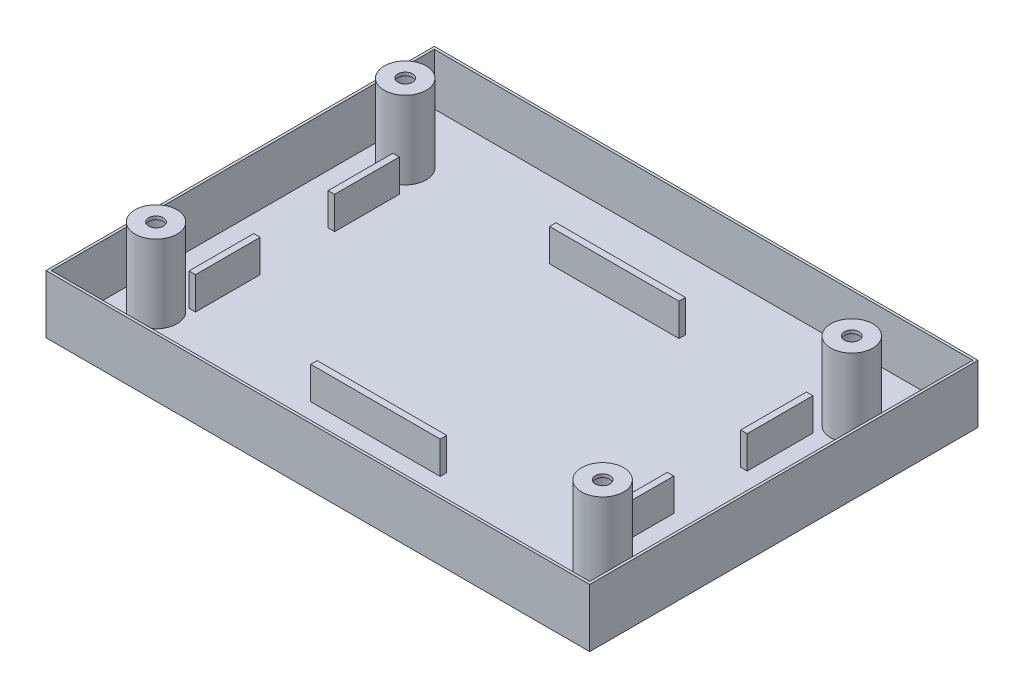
SolidWorks part; units mm, degrees
ref_plane "Front Plane" through (0, 0, 0) normal (0, 0, 1) x (1, 0, 0)
ref_plane "Top Plane" through (0, 0, 0) normal (0, 1, 0) x (1, 0, 0)
ref_plane "Right Plane" through (0, 0, 0) normal (1, 0, 0) x (0, 0, -1)
sketch "Sketch4" plane through (0, 0, 0) normal (0, 1, 0) x (1, 0, 0)
  line L1 (0, 0) -> (84, 0)
  line L2 (0, 0) -> (0, 60)
  line L3 (0, 60) -> (84, 60)
  line L4 (84, 0) -> (84, 60)
  dimension "D1" = 60
  dimension "D2" = 84
extrude "Boss-Extrude2" add sketch "Sketch4" along normal blind 9 contours L2 L1 L4 L3
sketch "Sketch5" plane through (0, 9, 0) normal (0, 1, 0) x (1, 0, 0)
  line L5 (0.4, 0.4) -> (83.6, 0.4)
  line L6 (0.4, 0.4) -> (0.4, 59.6)
  line L7 (0.4, 59.6) -> (83.6, 59.6)
  line L8 (83.6, 0.4) -> (83.6, 59.6)
  dimension "D1" = 59.2
  dimension "D2" = 83.2
extrude "Cut-Extrude2" cut sketch "Sketch5" against normal blind 8
sketch "Sketch6" plane through (0, 0, 0) normal (0, -1, 0) x (1, 0, 0)
  line L1 (79, -7) -> (2, -7)
  line L2 (79, -7) -> (79, -53.5)
  line L3 (79, -53.5) -> (2, -53.5)
  line L4 (2, -7) -> (2, -53.5)
  dimension "D1" = 46.5
  dimension "D2" = 77
sketch "Sketch7" plane through (0, 0, 0) normal (0, -1, 0) x (-1, 0, 0)
  circle A0 centre (-6, 11) radius 0.75
  circle A1 centre (-6, 49.5) radius 0.75
  circle A2 centre (-75, 49.5) radius 0.75
  circle A3 centre (-75, 11) radius 0.75
sketch "Sketch8" plane through (0, 1, 0) normal (0, 1, 0) x (1, 0, 0)
  line L1 (9.5, 12) -> (71.7, 12)
  line L2 (9.5, 12) -> (9.5, 47.5)
  line L3 (9.5, 47.5) -> (71.7, 47.5)
  line L4 (71.7, 12) -> (71.7, 47.5)
  dimension "D1" = 35.5
  dimension "D2" = 62.2
sketch "Sketch9" plane through (0, 1, 0) normal (0, 1, 0) x (1, 0, 0)
  line L0 (8.1, 35.5) -> (9.1, 35.5)
  line L1 (8.1, 14) -> (9.1, 14)
  line L2 (8.1, 14) -> (8.1, 24)
  line L3 (8.1, 24) -> (9.1, 24)
  line L4 (9.1, 14) -> (9.1, 24)
  line L5 (8.1, 35.5) -> (8.1, 45.5)
  line L6 (8.1, 45.5) -> (9.1, 45.5)
  line L7 (9.1, 35.5) -> (9.1, 45.5)
  line L8 (72, 45.5) -> (73, 45.5)
  line L9 (72, 14) -> (73, 14)
  line L10 (72, 14) -> (72, 24)
  line L11 (72, 24) -> (73, 24)
  line L12 (73, 14) -> (73, 24)
  line L13 (72, 45.5) -> (72, 35.3402)
  line L14 (72, 35.3402) -> (73, 35.3402)
  line L15 (73, 45.5) -> (73, 35.3402)
  line L17 (30, 47.8) -> (50, 47.8)
  line L18 (30, 47.8) -> (30, 48.8)
  line L19 (30, 48.8) -> (50, 48.8)
  line L20 (50, 47.8) -> (50, 48.8)
  line L25 (30, 10.9) -> (50, 10.9)
  line L26 (30, 10.9) -> (30, 11.9)
  line L27 (30, 11.9) -> (50, 11.9)
  line L28 (50, 10.9) -> (50, 11.9)
  dimension "D1" = 10
  dimension "D2" = 1
  dimension "D3" = 10
  dimension "D4" = 1
  dimension "D5" = 10
  dimension "D6" = 1
  dimension "D7" = 1
  dimension "D8" = 1
  dimension "D9" = 20
  dimension "D10" = 1
  dimension "D11" = 20
extrude "Boss-Extrude4" add sketch "Sketch9" along normal blind 5
sketch "Sketch10" plane through (0, 0, 0) normal (0, -1, 0) x (1, 0, 0)
  circle A0 centre (6, -11) radius 3.25
  circle A1 centre (6, -49.5) radius 3.25
  circle A2 centre (75, -11) radius 3.25
  circle A3 centre (75, -49.5) radius 3.25
extrude "Boss-Extrude5" add sketch "Sketch10" against normal blind 13
sketch "Sketch11" plane through (0, 0, 0) normal (0, -1, 0) x (1, 0, 0)
  circle A0 centre (6, -11) radius 2.9
  circle A1 centre (6, -49.5) radius 2.9
  circle A2 centre (75, -11) radius 2.9
  circle A3 centre (75, -49.5) radius 2.9
extrude "Cut-Extrude3" cut sketch "Sketch11" against normal blind 12.5
sketch "Sketch12" plane through (0, 12.5, 0) normal (0, -1, 0) x (1, 0, 0)
  point P0 (6, -49.5)
  point P1 (6, -11)
  point P2 (75, -11)
  point P4 (75, -49.5)
hole_wizard "#4-40 Tapped Hole2" positions "3DSketch1" profile "Sketch15" tap size "#4-40" standard "ANSI Inch"
sketch3d "3DSketch1"
  line L0 (6, 12.5, -49.5) -> (6, 0, -49.5) construction
  point P0 (6, 12.5, -49.5)
sketch "Sketch15" plane through (6, 12.5, -49.5) normal (1, 0, 0) x (0, 0, -1)
  line L0 (0, 0) -> (0, 0.5)
  line L1 (0, 0.5) -> (1.1303, 0.5)
  line L2 (1.1303, 0.5) -> (1.1303, 0)
  line L5 (1.1303, 0) -> (0, 0)
  line L11 (0, -6.35) -> (0, 107.95) construction
  dimension "Thru Tap Drill Dia." = 2.2606
  dimension "Thru Tap Drill Depth" = 0.5
hole_wizard "#4-40 Tapped Hole3" positions "Sketch18" profile "Sketch17" tap size "#4-40" standard "ANSI Inch"
sketch "Sketch18" plane through (0, 12.5, 0) normal (0, -1, 0) x (-1, 0, 0)
  point P0 (-6, 11)
  point P3 (-75, 11)
  point P6 (-75, 49.5)
sketch "Sketch17" plane through (6, 12.5, -11) normal (1, 0, 0) x (0, 0, -1)
  line L0 (0, 0) -> (0, 0.5)
  line L1 (0, 0.5) -> (1.1303, 0.5)
  line L2 (1.1303, 0.5) -> (1.1303, 0)
  line L5 (1.1303, 0) -> (0, 0)
  line L11 (0, -6.35) -> (0, 107.95) construction
  dimension "Thru Tap Drill Dia." = 2.2606
  dimension "Thru Tap Drill Depth" = 0.5
